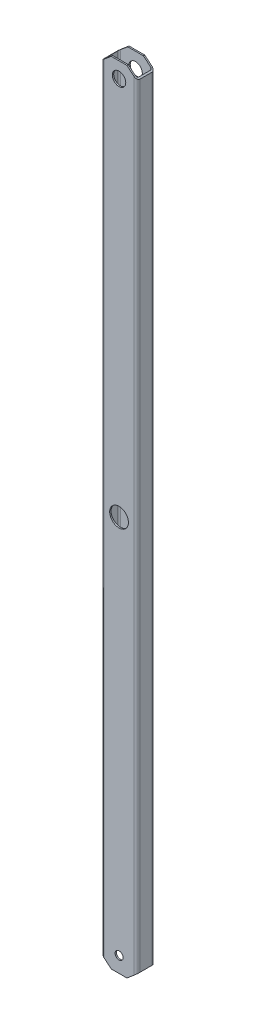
SolidWorks part; units mm, degrees
ref_plane "Piano frontale" through (0, 0, 0) normal (0, 0, 1) x (1, 0, 0)
ref_plane "Piano superiore" through (0, 0, 0) normal (0, 1, 0) x (1, 0, 0)
ref_plane "Piano destro" through (0, 0, 0) normal (1, 0, 0) x (0, 0, -1)
sketch "Schizzo1" plane through (0, 0, 0) normal (1, 0, 0) x (0, 0, -1)
  line L0 (0, 885) -> (0, -885)
  point P3 (0, 0)
  dimension "D1" = 1770
other "Tubo rettangolare 80 X 40 X 3.0(2)"
ref_plane "Piano1" through (0, 885, 0) normal (0, -1, 0) x (0, 0, -1)
sketch "Sketch15" plane through (0, 885, 0) normal (0, -1, 0) x (0, 0, -1)
  line L0 (-13.6, -37) -> (13.6, -37)
  line L1 (-17, -33.6) -> (-17, 33.6)
  line L2 (13.6, 37) -> (-13.6, 37)
  line L3 (17, 33.6) -> (17, -33.6)
  line L4 (-13.6, -40) -> (13.6, -40)
  line L5 (-20, -33.6) -> (-20, 33.6)
  line L6 (13.6, 40) -> (-13.6, 40)
  line L7 (20, 33.6) -> (20, -33.6)
  line L8 (-20, 0) -> (-17, 0) construction
  line L9 (-17, 0) -> (17, 0) construction
  line L10 (17, 0) -> (20, 0) construction
  line L11 (0, 40) -> (0, 37) construction
  line L12 (0, 37) -> (0, -37) construction
  line L13 (0, -37) -> (0, -40) construction
  arc A0 (20, 33.6) -> (13.6, 40) centre (13.6, 33.6) ccw
  arc A1 (13.6, -40) -> (20, -33.6) centre (13.6, -33.6) ccw
  arc A2 (-20, -33.6) -> (-13.6, -40) centre (-13.6, -33.6) ccw
  arc A3 (-13.6, 40) -> (-20, 33.6) centre (-13.6, 33.6) ccw
  arc A4 (-13.6, 37) -> (-17, 33.6) centre (-13.6, 33.6) ccw
  arc A5 (17, 33.6) -> (13.6, 37) centre (13.6, 33.6) ccw
  arc A6 (13.6, -37) -> (17, -33.6) centre (13.6, -33.6) ccw
  arc A7 (-17, -33.6) -> (-13.6, -37) centre (-13.6, -33.6) ccw
  point P6 (-20, 40)
  point P33 (-20, -40)
  point P34 (20, -40)
  point P36 (20, 40)
  point P37 (0, 0)
  dimension "D1" = 6.4
  dimension "Thickness" = 3
  dimension "V_leg" = 80
  dimension "H_leg" = 40
sketch "Schizzo8" plane through (0, 0, 20) normal (0, 0, 1) x (1, 0, 0)
  line L0 (-40, 866.1203) -> (-17.5, 885)
  line L1 (-40, -885) -> (-40, 885) construction
  line L2 (44, 885) -> (-44, 885) construction
  line L3 (-17.5, 885) -> (-40, 885)
  line L4 (-40, 885) -> (-40, 866.1203)
  line L5 (0, 0) -> (0, 885) construction
  line L6 (33.6, 885) -> (-33.6, 885) construction
  line L7 (17.5, 885) -> (40, 885)
  line L8 (40, 866.1203) -> (17.5, 885)
  line L9 (40, 885) -> (40, 866.1203)
  line L10 (0, 0) -> (40, 0) construction
  line L11 (40, -885) -> (40, 885) construction
  line L12 (40, -866.1203) -> (17.5, -885)
  line L13 (40, -885) -> (40, -866.1203)
  line L14 (17.5, -885) -> (40, -885)
  line L15 (-17.5, -885) -> (-40, -885)
  line L16 (-40, -866.1203) -> (-17.5, -885)
  line L17 (-40, -885) -> (-40, -866.1203)
  line L18 (33.6, -885) -> (-33.6, -885) construction
  circle A0 centre (0, 850) radius 15
  circle A2 centre (0, 0) radius 21
  circle A3 centre (0, -850) radius 9
  dimension "D3" = 30
  dimension "D5" = 42
  dimension "D6" = 18
  dimension "D1" = 230
  dimension "D2" = 35
  dimension "D4" = 35
  dimension "D7" = 35
extrude "Taglio-Estrusione1" cut sketch "Schizzo8" against normal up to surface (40 mm away)
sketch "Linee di piegatura1" [suppressed] plane through (0, 0, 0) normal (0, 1, 0) x (1, 0, 0)
sketch "Casella di contorno1" [suppressed] plane through (0, 0, 0) normal (0, 1, 0) x (1, 0, 0)
sketch "Sketch11" plane through (0, 885, 0) normal (0, -1, 0) x (0, 0, -1)
  line L0 (-9, -47) -> (9, -47)
  line L1 (-12, -44) -> (-12, 44)
  line L2 (9, 47) -> (-9, 47)
  line L3 (12, 44) -> (12, -44)
  line L4 (-9, -50) -> (9, -50)
  line L5 (-15, -44) -> (-15, 44)
  line L6 (9, 50) -> (-9, 50)
  line L7 (15, 44) -> (15, -44)
  line L8 (-15, 0) -> (-12, 0) construction
  line L9 (-12, 0) -> (12, 0) construction
  line L10 (12, 0) -> (15, 0) construction
  line L11 (0, 50) -> (0, 47) construction
  line L12 (0, 47) -> (0, -47) construction
  line L13 (0, -47) -> (0, -50) construction
  arc A0 (15, 44) -> (9, 50) centre (9, 44) ccw
  arc A1 (9, -50) -> (15, -44) centre (9, -44) ccw
  arc A2 (-15, -44) -> (-9, -50) centre (-9, -44) ccw
  arc A3 (-9, 50) -> (-15, 44) centre (-9, 44) ccw
  arc A4 (-9, 47) -> (-12, 44) centre (-9, 44) ccw
  arc A5 (12, 44) -> (9, 47) centre (9, 44) ccw
  arc A6 (9, -47) -> (12, -44) centre (9, -44) ccw
  arc A7 (-12, -44) -> (-9, -47) centre (-9, -44) ccw
  point P6 (-15, 50)
  point P33 (-15, -50)
  point P34 (15, -50)
  point P36 (15, 50)
  point P37 (0, 0)
  dimension "D1" = 6
  dimension "Thickness" = 3
  dimension "V_leg" = 100
  dimension "H_leg" = 30
equation "\"Lam_vern\"= 2 * ( \"SW-Massa\" / \"SW-Densità\" ) / ( \"Spessore\" / 1000 )"
